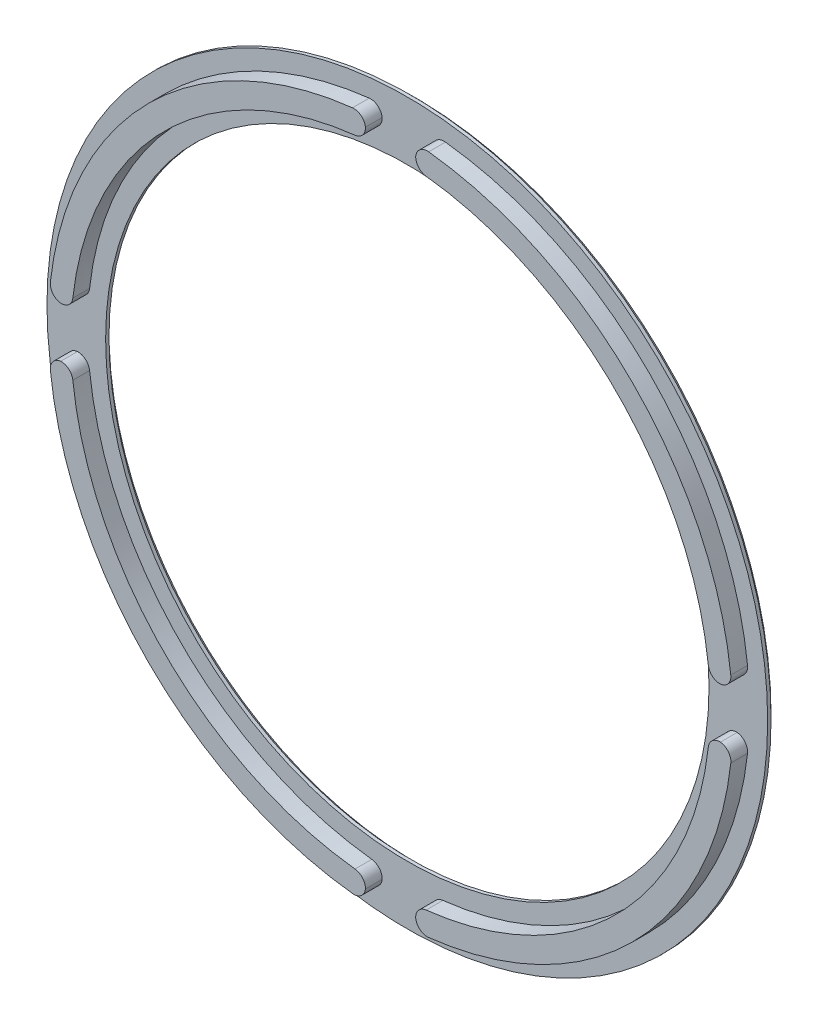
SolidWorks part; units mm, degrees
ref_plane "Ebene vorne" through (0, 0, 0) normal (0, 0, 1) x (1, 0, 0)
ref_plane "Ebene oben" through (0, 0, 0) normal (0, 1, 0) x (1, 0, 0)
ref_plane "Ebene rechts" through (0, 0, 0) normal (1, 0, 0) x (0, 0, -1)
sketch "Skizze1" plane through (0, 0, 0) normal (0, 0, 1) x (1, 0, 0)
  circle A0 centre (0, 0) radius 36
  circle A1 centre (0, 0) radius 43
  circle A4 centre (0, 0) radius 39.5 construction
extrude "Aufsatz-Linear austragen1" add sketch "Skizze1" along normal blind 0.9
sketch "Skizze2" plane through (0, 0, 0.9) normal (0, 0, 1) x (1, 0, 0)
  line L0 (0, 36) -> (0, 43) construction
  arc A0 (3, 39.3859) -> (39.3859, 3) centre (0, 0) cw
  arc A1 (39.3859, -3) -> (3, -39.3859) centre (0, 0) cw
  arc A2 (-3, -39.3859) -> (-39.3859, -3) centre (0, 0) cw
  arc A3 (-39.3859, 3) -> (-3, 39.3859) centre (0, 0) cw
  circle A4 centre (0, 0) radius 36 construction
  circle A5 centre (0, 0) radius 43 construction
  circle A6 centre (0, 0) radius 39.5 construction
  point P13 (0, 0)
  point P19 (0, 39.5)
  dimension "D2" = 3
  dimension "D3" = 3
  dimension "D5" = 3
  dimension "D4" = 4
extrude "Linear-Austragen-Dünn1" add sketch "Skizze2" along normal blind 2 thin
chamfer "Fase1" distance 0.5 angle 45 2 edges at (36, 0, 0) (43, 0, 0)
fillet "Verrundung1" radius 1.4 16 edges at (-3.1025, 40.732, 1.9) (-40.732, 3.1025, 1.9) (-38.0398, 2.8975, 1.9) (-2.8975, 38.0398, 1.9) (-40.732, -3.1025, 1.9) (-3.1025, -40.732, 1.9) (-2.8975, -38.0398, 1.9) (-38.0398, -2.8975, 1.9) (3.1025, -40.732, 1.9) (40.732, -3.1025, 1.9) (38.0398, -2.8975, 1.9) (2.8975, -38.0398, 1.9) (40.732, 3.1025, 1.9) (3.1025, 40.732, 1.9) (38.0398, 2.8975, 1.9) (2.8975, 38.0398, 1.9)
equation "\"D2@Skizze1\"=\"D1@led-ring-diameter-ref@booth-100-000_003-1.Part\""
